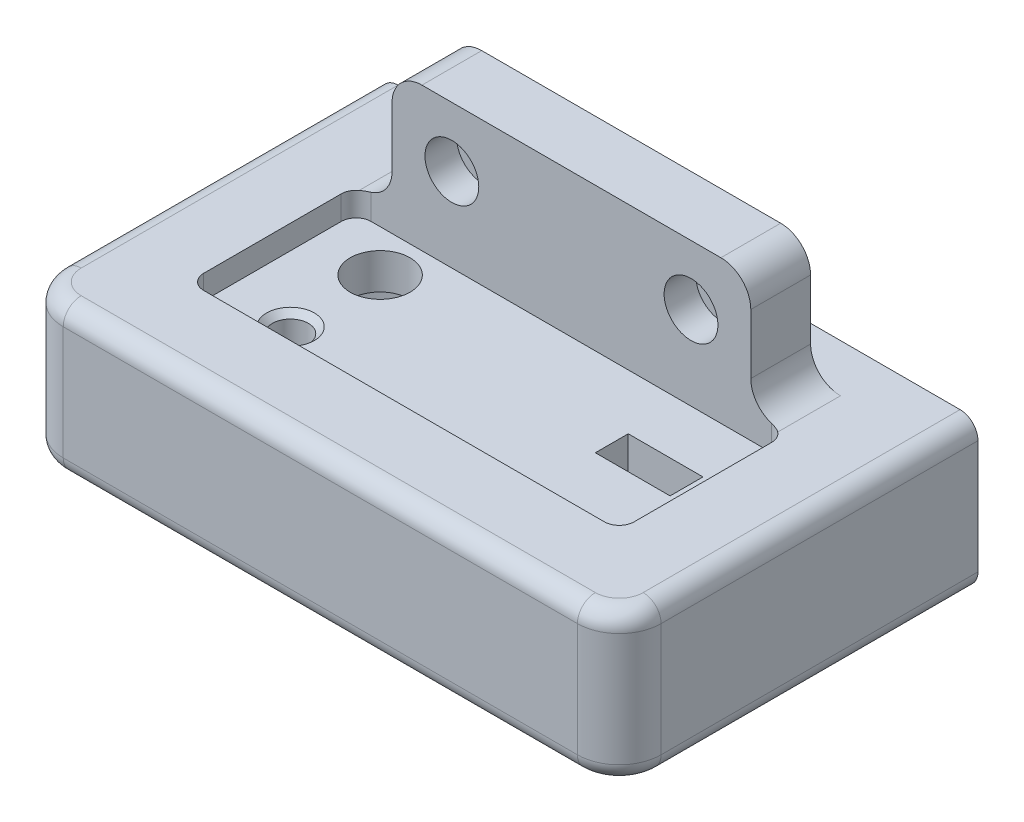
SolidWorks part; units mm, degrees
ref_plane "Front Plane" through (0, 0, 0) normal (0, 0, 1) x (1, 0, 0)
ref_plane "Top Plane" through (0, 0, 0) normal (0, 1, 0) x (1, 0, 0)
ref_plane "Right Plane" through (0, 0, 0) normal (1, 0, 0) x (0, 0, -1)
sketch "Sketch1" plane through (0, 0, 0) normal (0, 0, 1) x (1, 0, 0)
  line L1 (0, 0) -> (100, 0)
  line L2 (0, 0) -> (0, 25)
  line L3 (0, 25) -> (100, 25)
  line L4 (100, 0) -> (100, 25)
  dimension "D1" = 25
  dimension "D2" = 100
extrude "Boss-Extrude1" add sketch "Sketch1" along normal blind 60
sketch "Sketch5" plane through (0, 25, 0) normal (0, 1, 0) x (1, 0, 0)
  line L0 (0, -60) -> (0, 0) construction
  line L1 (20, -8) -> (80, -8)
  line L2 (20, -8) -> (20, -18)
  line L3 (20, -18) -> (80, -18)
  line L4 (80, -8) -> (80, -18)
  line L5 (100, 0) -> (0, 0) construction
  dimension "D1" = 60
  dimension "D2" = 10
  dimension "D3" = 20
  dimension "D4" = 8
extrude "Boss-Extrude2" add sketch "Sketch5" along normal blind 20
sketch "Sketch6" plane through (0, 0, 8) normal (0, 0, -1) x (-1, 0, 0)
  line L0 (-80, 25) -> (-20, 25) construction
  line L1 (-80, 45) -> (-80, 25) construction
  circle A0 centre (-70, 35) radius 3
  circle A1 centre (-30, 35) radius 3
  dimension "D1" = 6
  dimension "D2" = 40
  dimension "D3" = 10
  dimension "D4" = 10
  dimension "D5" = 10
extrude "Cut-Extrude2" cut sketch "Sketch6" against normal blind 10
sketch "Sketch7" plane through (0, 0, 0) normal (0, -1, 0) x (1, 0, 0)
  line L0 (0, 60) -> (0, 53)
  line L1 (0, 60) -> (0, 0) construction
  line L2 (0, 60) -> (7, 60)
  line L3 (0, 60) -> (100, 60) construction
  line L4 (100, 60) -> (93, 60)
  line L5 (100, 60) -> (100, 53)
  line L6 (100, 60) -> (100, 0) construction
  arc A0 (0, 53) -> (7, 60) centre (7, 53) cw
  arc A1 (93, 60) -> (100, 53) centre (93, 53) cw
  dimension "D1" = 7
  dimension "D2" = 7
  dimension "D3" = 7
  dimension "D4" = 7
extrude "Cut-Extrude3" cut sketch "Sketch7" against normal through all
fillet "Fillet1" radius 3 10 edges at (100, 25, 26.5) (97.9497, 25, 57.9497) (50, 25, 60) (2.0503, 25, 57.9497) (0, 25, 26.5) (2.0503, 0, 57.9497) (0, 0, 26.5) (97.9497, 0, 57.9497) (50, 0, 60) (100, 0, 26.5)
sketch "Sketch8" plane through (0, 0, 0) normal (0, -1, 0) x (1, 0, 0)
  line L0 (0, 0) -> (0, 53) construction
  line L1 (100, 53) -> (100, 0) construction
  line L2 (3, 0) -> (97, 0) construction
  circle A0 centre (25, 30) radius 20
  circle A1 centre (75, 30) radius 20
  dimension "D1" = 40
  dimension "D2" = 40
  dimension "D3" = 25
  dimension "D4" = 25
  dimension "D5" = 30
  dimension "D6" = 30
extrude "Cut-Extrude4" cut sketch "Sketch8" against normal blind 15
sketch "Sketch9" plane through (0, 0, 18) normal (0, 0, 1) x (1, 0, 0)
  circle A0 centre (30, 35) radius 4.5
  circle A1 centre (70, 35) radius 4.5
  dimension "D1" = 9
  dimension "D2" = 9
extrude "Cut-Extrude5" cut sketch "Sketch9" against normal blind 5.3
sketch "Sketch10" plane through (0, 15, 0) normal (0, -1, 0) x (1, 0, 0)
  line L0 (0, 0) -> (0, 53) construction
  line L2 (3, 0) -> (97, 0) construction
  line L5 (68.75, 27.25) -> (81.25, 27.25)
  line L6 (68.75, 27.25) -> (68.75, 32.75)
  line L7 (68.75, 32.75) -> (81.25, 32.75)
  line L8 (81.25, 27.25) -> (81.25, 32.75)
  line L9 (68.75, 27.25) -> (81.25, 32.75) construction
  line L10 (68.75, 32.75) -> (81.25, 27.25) construction
  circle A3 centre (25, 25) radius 5
  circle A6 centre (25, 40) radius 3
  point P2 (75, 30)
  dimension "D1" = 15
  dimension "D4" = 25
  dimension "D2" = 10
  dimension "D3" = 6
  dimension "D5" = 12.5
  dimension "D6" = 5.5
  dimension "D7" = 25
  dimension "D8" = 25
extrude "Cut-Extrude6" cut sketch "Sketch10" against normal blind 10
sketch "Sketch11" plane through (0, 25, 0) normal (0, 1, 0) x (1, 0, 0)
  line L0 (20, -18) -> (80, -18) construction
  line L1 (16.5, -46) -> (83.5, -46)
  line L2 (14, -43.5) -> (14, -20.5)
  line L3 (16.5, -18) -> (83.5, -18)
  line L4 (86, -43.5) -> (86, -20.5)
  line L5 (100, 0) -> (100, -53) construction
  arc A0 (83.5, -46) -> (86, -43.5) centre (83.5, -43.5) ccw
  arc A1 (16.5, -46) -> (14, -43.5) centre (16.5, -43.5) cw
  arc A2 (83.5, -18) -> (86, -20.5) centre (83.5, -20.5) cw
  arc A3 (14, -20.5) -> (16.5, -18) centre (16.5, -20.5) cw
  point P13 (14, -46)
  point P18 (14, -18)
  dimension "D5" = 2.5
  dimension "D1" = 0
  dimension "D2" = 28
  dimension "D3" = 14
  dimension "D4" = 14
extrude "Cut-Extrude7" cut sketch "Sketch11" against normal blind 4
chamfer "Chamfer2" distance 1 angle 45 1 edges at (25, 21, 43)
fillet "Redondeo1" radius 5 4 edges at (20, 25, 13) (20, 45, 13) (80, 45, 13) (80, 25, 13)
